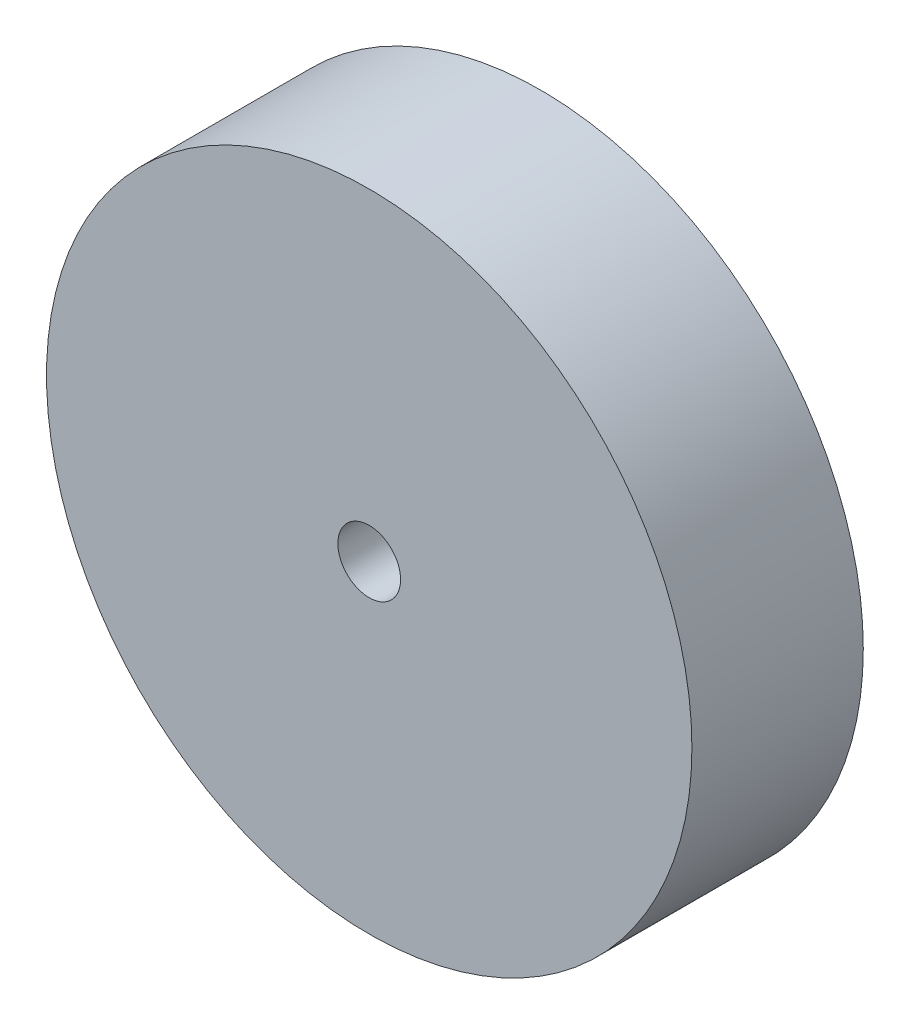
SolidWorks part; units mm, degrees
ref_plane "Front Plane" through (0, 0, 0) normal (0, 0, 1) x (1, 0, 0)
ref_plane "Top Plane" through (0, 0, 0) normal (0, 1, 0) x (1, 0, 0)
ref_plane "Right Plane" through (0, 0, 0) normal (1, 0, 0) x (0, 0, -1)
sketch "Sketch1" plane through (0, 0, 0) normal (0, 0, 1) x (1, 0, 0)
  circle A0 centre (0, 0) radius 0.375
  circle A1 centre (0, 0) radius 3.86
  dimension "D1" = 0.75
  dimension "D2" = 7.72
extrude "Boss-Extrude1" add sketch "Sketch1" along normal blind 2.05
